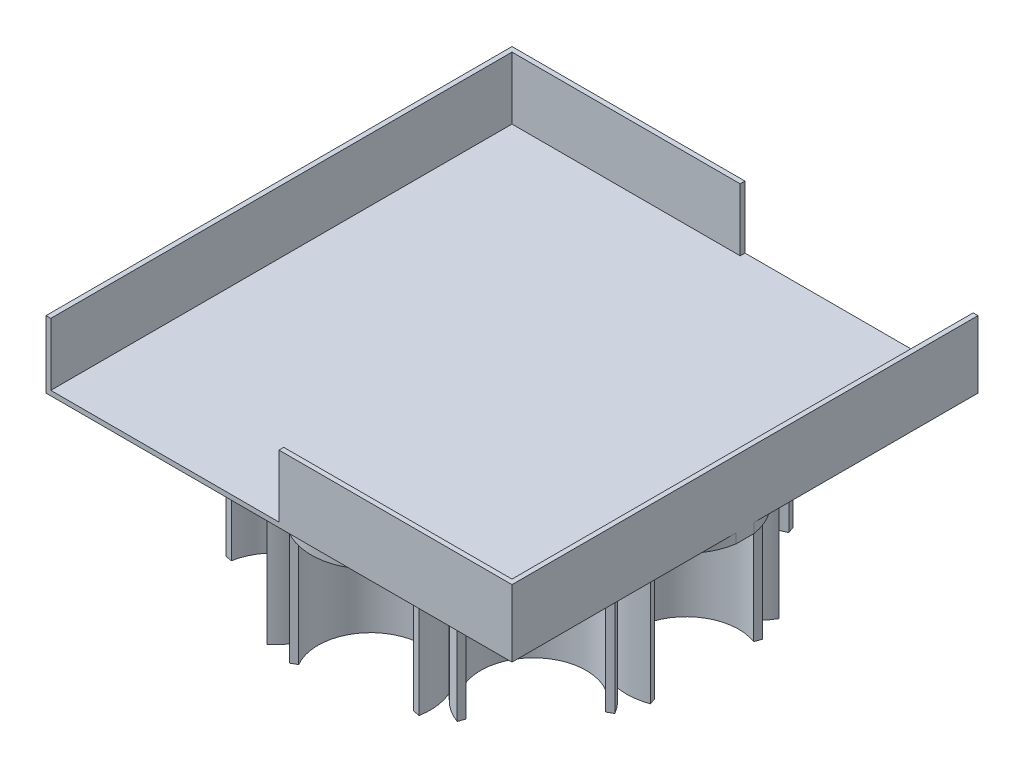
SolidWorks part; units mm, degrees
ref_plane "Front Plane" through (0, 0, 0) normal (0, 0, 1) x (1, 0, 0)
ref_plane "Top Plane" through (0, 0, 0) normal (0, 1, 0) x (1, 0, 0)
ref_plane "Right Plane" through (0, 0, 0) normal (1, 0, 0) x (0, 0, -1)
sketch "Sketch1" plane through (0, 0, 0) normal (0, 1, 0) x (1, 0, 0)
  line L1 (-65.5729, 48.209) -> (57.8076, 48.209)
  line L2 (-65.5729, 48.209) -> (-65.5729, -75.1715)
  line L3 (-65.5729, -75.1715) -> (57.8076, -75.1715)
  line L4 (57.8076, 48.209) -> (57.8076, -75.1715)
  dimension "D1" = 123.3805
  dimension "D2" = 123.3805
extrude "Boss-Extrude1" add sketch "Sketch1" along normal blind 1.27 contours L4 L1 L2 L3
sketch "Sketch3" plane through (0, 0, 0) normal (0, 1, 0) x (1, 0, 0)
  line L0 (-3.8826, -73.9015) -> (-3.8826, -75.1715)
  line L1 (-65.5729, 48.209) -> (57.8076, 48.209)
  line L2 (-65.5729, 48.209) -> (-65.5729, -75.1715)
  line L3 (-65.5729, -75.1715) -> (57.8076, -75.1715)
  line L4 (57.8076, 48.209) -> (57.8076, -75.1715)
  line L5 (-64.3029, 46.939) -> (56.5376, 46.939)
  line L6 (-64.3029, 46.939) -> (-64.3029, -73.9015)
  line L7 (-64.3029, -73.9015) -> (56.5376, -73.9015)
  line L8 (56.5376, 46.939) -> (56.5376, -73.9015)
  line L9 (-3.8826, 48.209) -> (-3.8826, 46.939)
  line L10 (-64.3029, -73.9015) -> (-64.3029, -75.1715)
  line L11 (56.5376, 46.939) -> (56.5376, 48.209)
extrude "Boss-Extrude3" add sketch "Sketch3" along normal blind 17.78 contours L10 L6 L5 L9 L1 L2 L3 | L11 L8 L7 L0 L3 L4 L1
sketch "Sketch4" plane through (0, 0, 0) normal (0, -1, 0) x (1, 0, 0)
  line L2 (56.1845, 13.4813) -> (73.1626, 13.4813) construction
  line L3 (46.9926, 26.6088) -> (47.6076, 28.2986)
  line L4 (46.9926, 0.3538) -> (47.6076, -1.3361)
  line L5 (43.5282, -9.1644) -> (45.0856, -8.2653)
  line L6 (26.6518, -29.2769) -> (26.0368, -30.9668)
  line L7 (17.8798, -34.3414) -> (19.6508, -34.6537)
  line L8 (-7.9763, -38.9006) -> (-9.5337, -39.7997)
  line L9 (-17.9514, -37.1417) -> (-16.7955, -38.5193)
  line L10 (-40.6889, -24.0142) -> (-42.4599, -23.7019)
  line L11 (-47.1997, -16.2549) -> (-47.1997, -18.0532)
  line L12 (-56.1795, 8.4168) -> (-57.3354, 9.7943)
  line L13 (-56.1795, 18.5458) -> (-57.3354, 17.1682)
  line L14 (-47.1997, 43.2174) -> (-47.1997, 45.0157)
  line L15 (-40.6889, 50.9767) -> (-42.4599, 50.6644)
  line L16 (-17.9514, 64.1042) -> (-16.7955, 65.4818)
  line L17 (-7.9763, 65.8631) -> (-9.5337, 66.7622)
  line L18 (17.8798, 61.3039) -> (19.6508, 61.6162)
  line L19 (26.6518, 56.2394) -> (26.0368, 57.9293)
  line L20 (43.5282, 36.1269) -> (45.0856, 35.2278)
  arc A0 (46.9926, 26.6088) -> (46.9926, 0.3538) centre (42.2145, 13.4813) ccw
  arc A1 (47.6076, 28.2986) -> (47.6076, -1.3361) centre (42.2145, 13.4813) ccw
  arc A2 (43.5282, -9.1644) -> (26.6518, -29.2769) centre (31.4299, -16.1494) ccw
  arc A3 (45.0856, -8.2653) -> (26.0368, -30.9668) centre (31.4299, -16.1494) ccw
  arc A4 (17.8798, -34.3414) -> (-7.9763, -38.9006) centre (4.1221, -31.9156) ccw
  arc A5 (19.6508, -34.6537) -> (-9.5337, -39.7997) centre (4.1221, -31.9156) ccw
  arc A6 (-17.9514, -37.1417) -> (-40.6889, -24.0142) centre (-26.9312, -26.44) ccw
  arc A7 (-16.7955, -38.5193) -> (-42.4599, -23.7019) centre (-26.9312, -26.44) ccw
  arc A8 (-47.1997, -16.2549) -> (-56.1795, 8.4168) centre (-47.1997, -2.2849) ccw
  arc A9 (-47.1997, -18.0532) -> (-57.3354, 9.7943) centre (-47.1997, -2.2849) ccw
  arc A10 (-56.1795, 18.5458) -> (-47.1997, 43.2174) centre (-47.1997, 29.2474) ccw
  arc A11 (-57.3354, 17.1682) -> (-47.1997, 45.0157) centre (-47.1997, 29.2474) ccw
  arc A12 (-40.6889, 50.9767) -> (-17.9514, 64.1042) centre (-26.9312, 53.4026) ccw
  arc A13 (-42.4599, 50.6644) -> (-16.7955, 65.4818) centre (-26.9312, 53.4026) ccw
  arc A14 (-7.9763, 65.8631) -> (17.8798, 61.3039) centre (4.1221, 58.8781) ccw
  arc A15 (-9.5337, 66.7622) -> (19.6508, 61.6162) centre (4.1221, 58.8781) ccw
  arc A16 (26.6518, 56.2394) -> (43.5282, 36.1269) centre (31.4299, 43.1119) ccw
  arc A17 (26.0368, 57.9293) -> (45.0856, 35.2278) centre (31.4299, 43.1119) ccw
  circle A18 centre (-3.8826, 13.4813) radius 13.97
  circle A19 centre (-3.8826, 13.4813) radius 15.7683
  point P13 (73.1626, -22.5104)
  point P17 (-3.8826, 13.4813)
  point P60 (-3.8826, 13.4813)
  dimension "D1" = 70
  dimension "D2" = 70
  dimension "D3" = 9
extrude "Boss-Extrude7" add sketch "Sketch4" along normal blind 38.1 contours A19 A18 | A2 L6 A3 L5 | A0 L4 A1 L3 | A16 L20 A17 L19 | A15 L18 A14 L17 | A13 L16 A12 L15 | A10 L14 A11 L13 | A8 L12 A9 L11 | A7 L10 A6 L9 | A4 L8 A5 L7
sketch "Sketch5" plane through (0, 0, 0) normal (0, -1, 0) x (1, 0, 0)
  circle A0 centre (31.4299, 43.1119) radius 15.7683
  circle A1 centre (31.4299, 43.1119) radius 13.97
  circle A2 centre (42.2145, 13.4813) radius 15.7683
  circle A3 centre (42.2145, 13.4813) radius 13.97
  circle A4 centre (31.4299, -16.1494) radius 15.7683
  circle A5 centre (31.4299, -16.1494) radius 13.97
  circle A6 centre (4.1221, -31.9156) radius 15.7683
  circle A7 centre (4.1221, -31.9156) radius 13.97
  circle A8 centre (-26.9312, -26.44) radius 15.7683
  circle A9 centre (-26.9312, -26.44) radius 13.97
  circle A10 centre (-47.1997, -2.2849) radius 15.7683
  circle A11 centre (-47.1997, -2.2849) radius 13.97
  circle A12 centre (-47.1997, 29.2474) radius 15.7683
  circle A13 centre (-47.1997, 29.2474) radius 13.97
  circle A14 centre (-26.9312, 53.4026) radius 15.7683
  circle A15 centre (-26.9312, 53.4026) radius 13.97
  circle A16 centre (4.1221, 58.8781) radius 15.7683
  circle A17 centre (4.1221, 58.8781) radius 13.97
  point P4 (-3.8826, 13.4813)
  point P32 (-3.8826, 13.4813)
  dimension "D1" = 9
extrude "Boss-Extrude9" add sketch "Sketch5" along normal blind 2.54 contours A7 A6 M18 M16 | A5 A4 M13 M11 | A3 A2 M8 M47 M6 | A1 A0 M3 M1 | A17 A16 M43 M41 | A15 A14 M38 M36 | A13 A12 M33 M31 | A11 A10 M28 M26 | A9 A8 M23 M21
